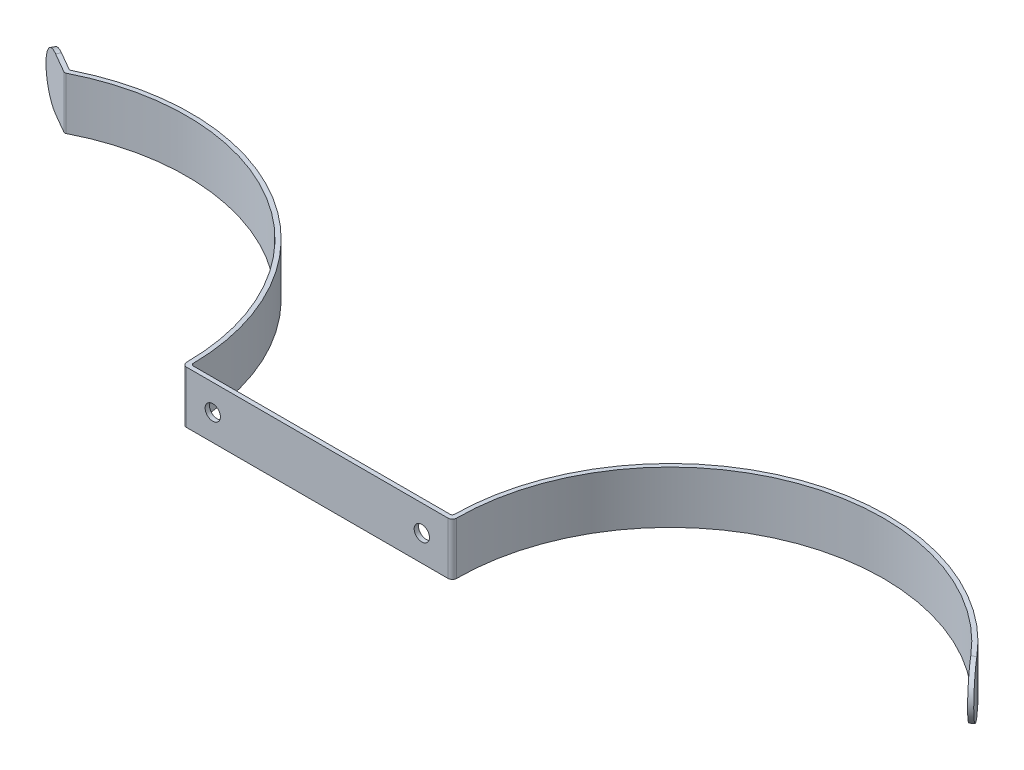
SolidWorks part; units mm, degrees
ref_plane "Front" through (0, 0, 0) normal (0, 0, 1) x (1, 0, 0)
ref_plane "Top" through (0, 0, 0) normal (0, 1, 0) x (1, 0, 0)
ref_plane "Right" through (0, 0, 0) normal (1, 0, 0) x (0, 0, -1)
sketch "Sketch1" plane through (0, 0, 0) normal (0, 1, 0) x (1, 0, 0)
  line L0 (50.4975, 0) -> (109.5025, 0)
  line L1 (50, -1) -> (110, -1)
  line L2 (50, 0) -> (110, 0) construction
  line L4 (-22.7669, 44.7692) -> (-32.0598, 50.1345)
  line L5 (-32.0598, 50.1345) -> (-32.5598, 49.2685)
  line L6 (-32.5598, 49.2685) -> (-22.7987, 43.6329)
  line L7 (202.1021, 27.6299) -> (201.3374, 26.9856)
  line L8 (198.2359, 32.2182) -> (202.1021, 27.6299)
  line L9 (197.4712, 31.5739) -> (201.3374, 26.9856)
  arc A0 (49.9975, 0.495) -> (-22.2939, 44.7547) centre (0, 0) ccw
  arc A1 (49, 0) -> (-22.321, 43.6208) centre (0, 0) ccw
  arc A2 (198.2359, 32.2182) -> (110.0025, 0.495) centre (160, 0) ccw
  arc A3 (197.4712, 31.5739) -> (111, 0) centre (160, 0) ccw
  arc A4 (49, 0) -> (50, -1) centre (50, 0) ccw
  arc A5 (110, -1) -> (111, 0) centre (110, 0) ccw
  arc A6 (49, 0) -> (-22.0829, 43.7418) centre (0, 0) ccw construction
  arc A7 (50, 0) -> (-22.5336, 44.6345) centre (0, 0) ccw construction
  arc A8 (-22.7669, 44.7692) -> (-22.2939, 44.7547) centre (-22.5169, 45.2022) ccw
  arc A9 (-22.7987, 43.6329) -> (-22.321, 43.6208) centre (-22.5487, 44.0659) ccw
  arc A10 (50.4975, 0) -> (49.9975, 0.495) centre (50.4975, 0.5) cw
  arc A11 (198.2359, 32.2182) -> (110, 0) centre (160, 0) ccw construction
  arc A12 (109.5025, 0) -> (110.0025, 0.495) centre (109.5025, 0.5) ccw
extrude "Extrude1" add sketch "Sketch1" along normal blind 12
sketch "Sketch2" plane through (0, 0, 0) normal (0, 0, -1) x (-1, 0, 0)
  circle A0 centre (-56, 6) radius 1.75
  circle A1 centre (-104, 6) radius 1.75
extrude "Cut-Extrude1" cut sketch "Sketch2" against normal through all
sketch "Sketch3" plane through (131.803, 0, -111.0594) normal (0.7647, 0, -0.6444) x (-0.6444, 0, -0.7647)
  line L0 (-103.0983, 12) -> (-103.0983, 0) construction
  line L1 (-103.0983, 12) -> (-109.0983, 12)
  line L2 (-109.0983, 12) -> (-109.0983, 0)
  line L3 (-109.0983, 0) -> (-103.0983, 0)
  arc A0 (-103.0983, 12) -> (-103.0983, 0) centre (-103.0983, 6) ccw
extrude "Cut-Extrude2" cut sketch "Sketch3" against normal through all contours A0 M3 M4 | A0 L2 M1
sketch "Sketch4" plane through (13.6939, 0, -23.7186) normal (0.5, 0, -0.866) x (-0.866, 0, -0.5)
  line L0 (52.8319, 12) -> (52.8319, 0)
  line L2 (46.8319, 12) -> (52.8319, 12)
  line L3 (46.8319, 0) -> (52.8319, 0)
  arc A0 (46.8319, 0) -> (46.8319, 12) centre (46.8319, 6) ccw
extrude "Cut-Extrude3" cut sketch "Sketch4" against normal through all contours A0 L0 M3 | A0 M2 M1
